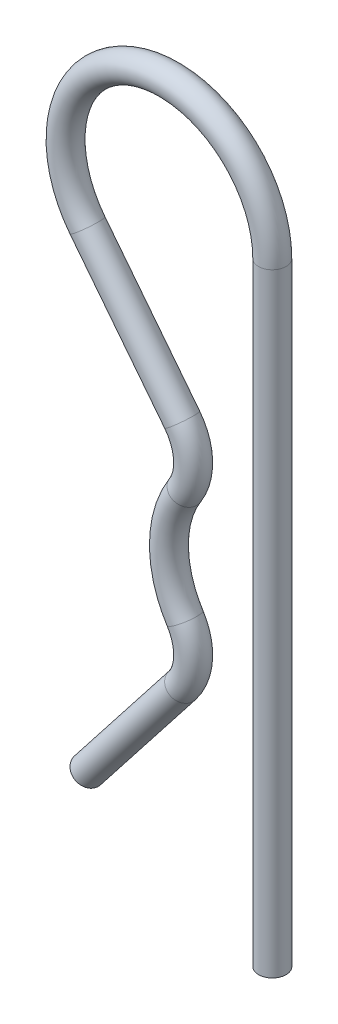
SolidWorks part; units mm, degrees
ref_plane "Plan1" through (0, 0, 0) normal (0, 0, 1) x (1, 0, 0)
ref_plane "Plan2" through (0, 0, 0) normal (0, 1, 0) x (1, 0, 0)
ref_plane "Plan3" through (0, 0, 0) normal (1, 0, 0) x (0, 0, -1)
sketch "Esquisse1" plane through (0, 0, 0) normal (0, 0, 1) x (1, 0, 0)
  line L0 (0, 0) -> (0, 30.5) construction
  line L1 (-13.405, 17.1189) -> (-6.5392, 8.3509) construction
  line L2 (0, 0) -> (-30.5, 0) construction
  line L4 (0, 21.7428) -> (0, 0) construction
  line L5 (0, 0) -> (0, -22.7572) construction
  line L6 (-7.5, 29.2428) -> (0, 29.2428) construction
  line L7 (-13.405, -17.1189) -> (-6.5392, -8.3509) construction
  circle A0 centre (0, 0) radius 30.5 construction
  arc A1 (0, 21.7428) -> (-13.405, 17.1189) centre (-7.5, 21.7428) ccw construction
  arc A2 (-6.3278, 4.026) -> (-6.3278, -4.026) centre (0, 0) ccw construction
  arc A3 (-6.5392, 8.3509) -> (-6.3278, 4.026) centre (-9.4917, 6.039) cw construction
  arc A5 (-6.3278, -4.026) -> (-6.5392, -8.3509) centre (-9.4917, -6.039) cw
  dimension "D1" = 61
  dimension "D2" = 15
  dimension "D3" = 15
  dimension "D7" = 3.75
  dimension "D4" = 3.75
  dimension "D6" = 52
sketch "Esquisse4" plane through (0, 0, 0) normal (0, 0, 1) x (1, 0, 0)
  line L7 (0, -22.7572) -> (0, 21.7428)
  line L8 (-13.405, 17.1189) -> (-6.5392, 8.3509) construction
  line L9 (-13.405, 17.1189) -> (-6.5392, 8.3509)
  line L10 (-13.405, -17.1189) -> (-6.5392, -8.3509) construction
  line L11 (-13.405, -17.1189) -> (-6.5392, -8.3509)
  arc A7 (0, 21.7428) -> (-13.405, 17.1189) centre (-7.5, 21.7428) ccw construction
  arc A8 (0, 21.7428) -> (-13.405, 17.1189) centre (-7.5, 21.7428) ccw
  arc A9 (-6.5392, -8.3509) -> (-6.3278, -4.026) centre (-9.4917, -6.039) ccw construction
  arc A10 (-6.3278, 4.026) -> (-6.3278, -4.026) centre (0, 0) ccw construction
  arc A11 (-6.3278, 4.026) -> (-6.5392, 8.3509) centre (-9.4917, 6.039) ccw construction
  arc A12 (-6.5392, -8.3509) -> (-6.3278, -4.026) centre (-9.4917, -6.039) ccw
  arc A13 (-6.3278, 4.026) -> (-6.3278, -4.026) centre (0, 0) ccw
  arc A14 (-6.3278, 4.026) -> (-6.5392, 8.3509) centre (-9.4917, 6.039) ccw
ref_plane "Plan5" through (0, -22.7572, 0) normal (0, 1, 0) x (-1, 0, 0)
sketch "Esquisse2" plane through (0, -22.7572, 0) normal (0, 1, 0) x (1, 0, 0)
  circle A0 centre (0, 0) radius 1
  dimension "D1" = 2
sweep "Base-Balayage" add profiles "Esquisse2" path "Esquisse4"
equation "\"D7@Esquisse1\"=\"D2@Esquisse1\"/4"
equation "\"D4@Esquisse1\"=\"D7@Esquisse1\""
